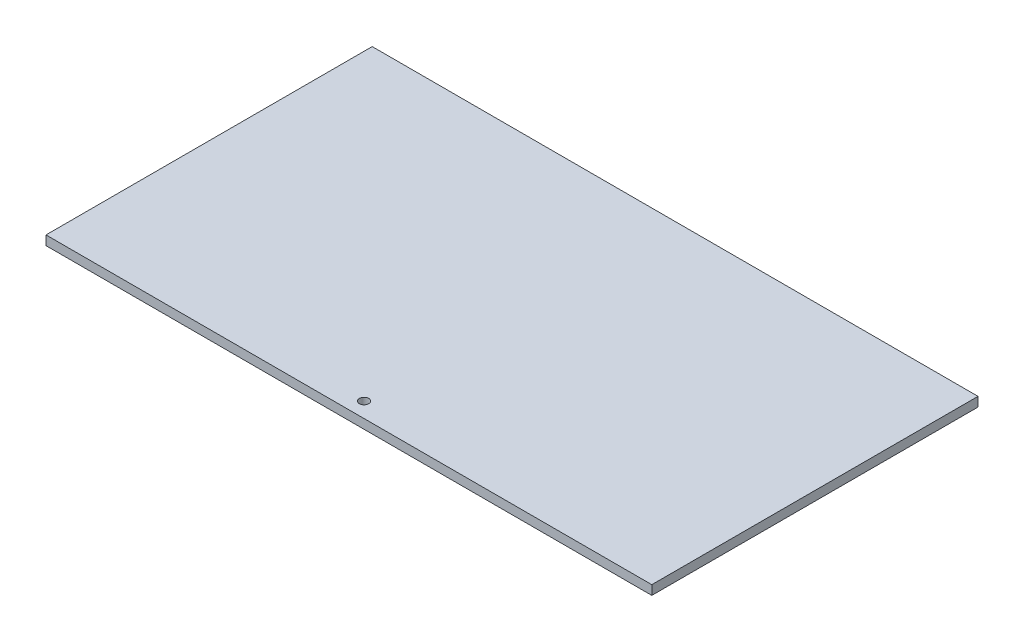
SolidWorks part; units mm, degrees
ref_plane "Front Plane" through (0, 0, 0) normal (0, 0, 1) x (1, 0, 0)
ref_plane "Top Plane" through (0, 0, 0) normal (0, 1, 0) x (1, 0, 0)
ref_plane "Right Plane" through (0, 0, 0) normal (1, 0, 0) x (0, 0, -1)
sketch "Sketch1" plane through (0, 0, 0) normal (0, 1, 0) x (1, 0, 0)
  line L1 (-65, 35) -> (65, 35)
  line L2 (-65, 35) -> (-65, -35)
  line L3 (-65, -35) -> (65, -35)
  line L4 (65, 35) -> (65, -35)
  line L5 (-65, 35) -> (65, -35) construction
  line L6 (-65, -35) -> (65, 35) construction
  point P0 (0, 0)
  dimension "D1" = 130
  dimension "D2" = 70
extrude "Boss-Extrude1" add sketch "Sketch1" along normal blind 2
sketch "Sketch2" plane through (0, 2, 0) normal (0, 1, 0) x (1, 0, 0)
  circle A0 centre (0, -31.7531) radius 1
extrude "Cut-Extrude1" cut sketch "Sketch2" against normal blind 2 contours A0
